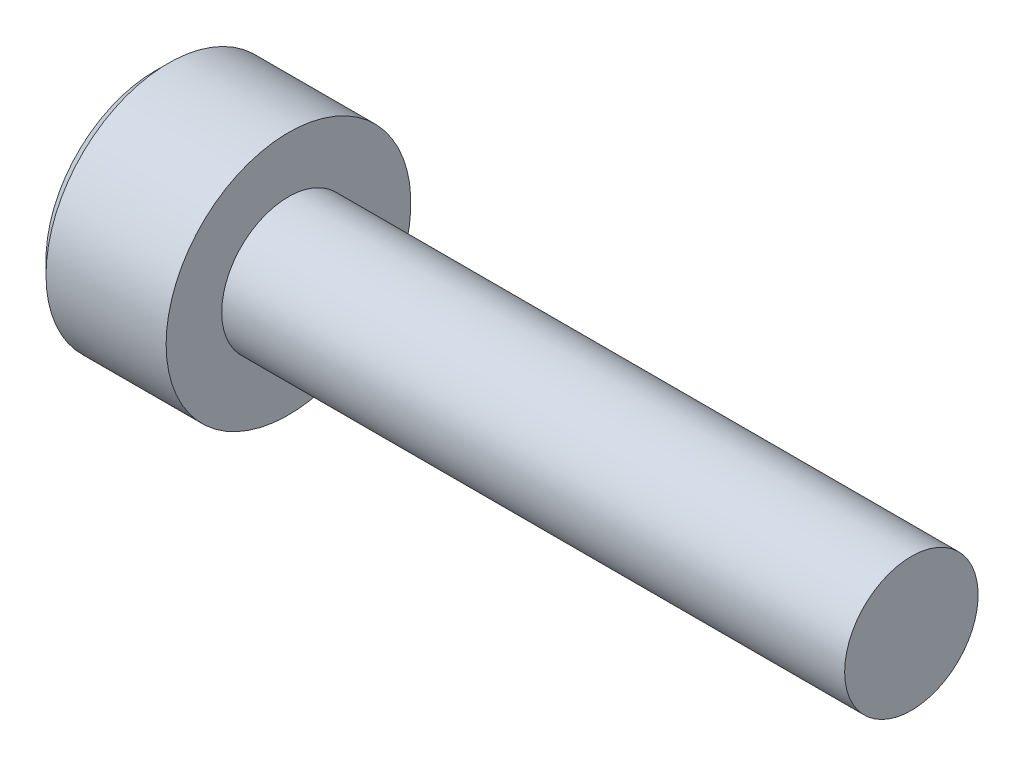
SolidWorks part; units mm, degrees
ref_plane "Front Plane" through (0, 0, 0) normal (0, 0, 1) x (1, 0, 0)
ref_plane "Top Plane" through (0, 0, 0) normal (0, 1, 0) x (1, 0, 0)
ref_plane "Right Plane" through (0, 0, 0) normal (1, 0, 0) x (0, 0, -1)
sketch "Sketch1" plane through (0, 0, 0) normal (0, 0, 1) x (1, 0, 0)
  line L2 (-3, 0) -> (14, 0)
  line L3 (14, 0) -> (14, 1.5)
  line L4 (14, 1.5) -> (0, 1.5)
  line L5 (0, 1.5) -> (0, 2.75)
  line L6 (0, 2.75) -> (-3, 2.75)
  line L7 (-3, 2.75) -> (-3, 0)
  line L8 (-3, 0) -> (14, 0) construction
  line L9 (0, 0) -> (0, 2.75) construction
  dimension "E" = 3
  dimension "L" = 14
  dimension "A" = 5.5
  dimension "M" = 3
revolve "Revolve1" add sketch "Sketch1" about L8
chamfer "Chamfer1" distance 0.3 1 edges at (-3, 0, 2.75)
sketch "Sketch2" plane through (0, 0, 0) normal (0, 0, 1) x (1, 0, 0)
  line L0 (-0.9489, 0) -> (-1.7, 1.25)
  line L1 (-3, 0) -> (14, 0) construction
  line L2 (-1.7, 1.25) -> (-3, 1.25)
  line L3 (-3, 2.75) -> (-3, 0) construction
  line L4 (-3, 1.25) -> (-3, 0)
  line L5 (-3, 0) -> (-0.9489, 0) construction
  line L6 (-0.9489, 0) -> (-3, 0)
  dimension "FIX_3" = 59
revolve "Cut-Revolve1" cut sketch "Sketch2" about L5
sketch "Sketch3" plane through (-3, 0, 0) normal (-1, 0, 0) x (0, 0, 1)
  line L0 (0, -1.4434) -> (0, 1.4434) construction
  line L1 (0, -1.4434) -> (1.25, -0.7217)
  line L2 (1.25, -0.7217) -> (1.25, 0.7217)
  line L3 (1.25, 0.7217) -> (0, 1.4434)
  line L4 (0, 1.4434) -> (-1.25, 0.7217)
  line L5 (-1.25, 0.7217) -> (-1.25, -0.7217)
  line L6 (-1.25, -0.7217) -> (0, -1.4434)
  line L7 (-1.25, 0) -> (1.25, 0) construction
  circle A0 centre (0, 0) radius 1.25 construction
extrude "Cut-Extrude1" cut sketch "Sketch3" against normal blind 1.3
